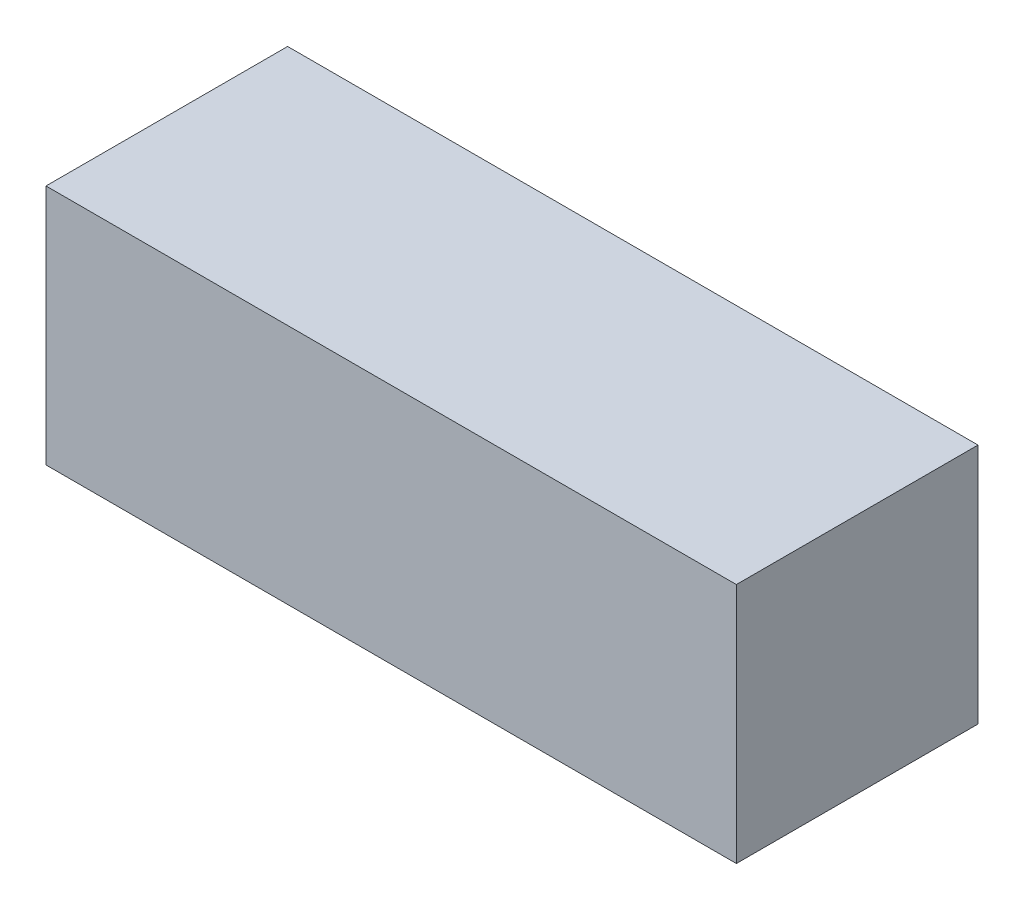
SolidWorks part; units mm, degrees
ref_plane "Front Plane" through (0, 0, 0) normal (0, 0, 1) x (1, 0, 0)
ref_plane "Top Plane" through (0, 0, 0) normal (0, 1, 0) x (1, 0, 0)
ref_plane "Right Plane" through (0, 0, 0) normal (1, 0, 0) x (0, 0, -1)
sketch "Sketch1" plane through (0, 0, 0) normal (0, 1, 0) x (1, 0, 0)
  line L1 (0, 0) -> (200, 0)
  line L2 (0, 0) -> (0, 70)
  line L3 (0, 70) -> (200, 70)
  line L4 (200, 0) -> (200, 70)
  dimension "D1" = 200
  dimension "D2" = 70
extrude "Boss-Extrude1" add sketch "Sketch1" along normal blind 70
